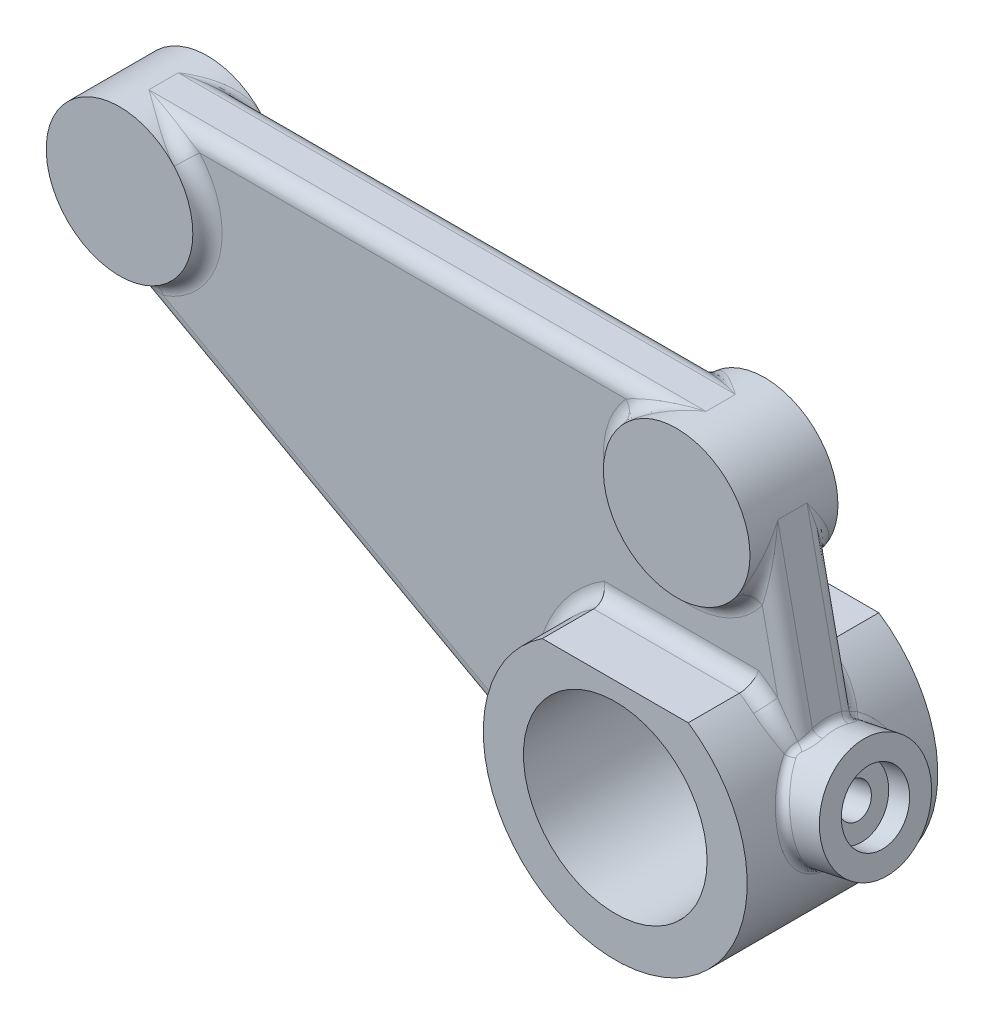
SolidWorks part; units mm, degrees
ref_plane "Front" through (0, 0, 0) normal (0, 0, 1) x (1, 0, 0)
ref_plane "Top" through (0, 0, 0) normal (0, 1, 0) x (1, 0, 0)
ref_plane "Right" through (0, 0, 0) normal (1, 0, 0) x (0, 0, -1)
sketch "Sketch1" plane through (0, 0, 0) normal (0, 0, 1) x (1, 0, 0)
  line L0 (-74.6231, 42) -> (1.3769, 42)
  line L1 (11.1584, 34.0791) -> (17.6067, 3.7424)
  line L2 (-8.6895, -15.7637) -> (-79.4506, 23.2424)
  line L3 (0, 0) -> (0, 28.3183) construction
  arc A0 (-74.6231, 42) -> (-79.4506, 23.2424) centre (-74.6231, 32) ccw
  arc A1 (11.1584, 34.0791) -> (1.3769, 42) centre (1.3769, 32) ccw
  arc A2 (17.6067, 3.7424) -> (-8.6895, -15.7637) centre (0, 0) cw
  dimension "D1" = 20
  dimension "D2" = 76
  dimension "D3" = 32
  dimension "D4" = 36
  dimension "D5" = 12
extrude "Base-Extrude" add sketch "Sketch1" along normal mid plane 8
sketch "Sketch2" plane through (0, 0, 0) normal (0, 0, 1) x (1, 0, 0)
  line L0 (-9.9499, 15) -> (9.9499, 15)
  arc A0 (-9.9499, 15) -> (9.9499, 15) centre (0, 0) ccw
  arc A1 (-8.6895, -15.7637) -> (17.6067, 3.7424) centre (0, 0) ccw construction
  arc A2 (-8.6895, -15.7637) -> (17.6067, 3.7424) centre (0, 0) ccw construction
  dimension "D1" = 15
extrude "Boss-Extrude1" add sketch "Sketch2" along normal mid plane 26
sketch "Sketch3" plane through (0, 0, 0) normal (0, 0, 1) x (1, 0, 0)
  circle A0 centre (-74.6231, 32) radius 10
  arc A1 (-74.6231, 42) -> (-79.4506, 23.2424) centre (-74.6231, 32) ccw construction
extrude "Boss-Extrude2" add sketch "Sketch3" along normal mid plane 12
sketch "Sketch4" plane through (119.7373, 2.0597, 0) normal (0, 0, 1) x (1, 0, 0)
  circle A0 centre (-118.3604, 29.9403) radius 10
  arc A2 (-108.5789, 32.0194) -> (-118.3604, 39.9403) centre (-118.3604, 29.9403) ccw construction
extrude "Boss-Extrude3" add sketch "Sketch4" along normal mid plane 12
sketch "Sketch6" plane through (0, 0, 0) normal (0, 0, 1) x (1, 0, 0)
  circle A0 centre (0, 0) radius 12.525
  dimension "D1" = 25.05
extrude "Cut-Extrude1" cut sketch "Sketch6" against normal through all and the other way through all
fillet "Fillet2" radius 2 6 edges at (14.3825, 18.9108, 4) (-36.6231, 42, 4) (-36.6231, 42, -4) (14.3825, 18.9108, -4) (-44.07, 3.7394, 4) (-44.07, 3.7394, -4)
fillet "Fillet3" radius 2 21 edges at (12.0783, 13.3459, -4) (12.0783, 13.3459, 4) (0, 15, 4) (-4.9163, 24.2285, -4) (-17.6519, 3.523, -4) (-64.9387, 29.5076, -4) (-4.9163, 24.2285, 4) (-64.9387, 29.5076, 4) (-17.6519, 3.523, 4) (-12.7501, -12.7057, -3.5349) (-75.0862, 22.0107, -3.748) (-12.7501, -12.7057, 3.5349) (-75.0862, 22.0107, 3.748) (-70.2064, 40.9718, -3.748) (-3.0398, 40.9718, -3.748) (-70.2064, 40.9718, 3.748) (-3.0398, 40.9718, 3.748) (11.0709, 29.5451, -3.748) (15.8583, 8.5155, -3.5349) (11.0709, 29.5451, 3.748) (15.8583, 8.5155, 3.5349)
ref_plane "cbore-pl" through (22.4974, 4.782, 0) normal (0.9781, 0.2079, 0) x (0, 0, -1)
sketch "Sketch8" plane through (22.4974, 4.782, 0) normal (0.9781, 0.2079, 0) x (0, 0, -1)
  circle A0 centre (0, 0) radius 7.5
  dimension "D1" = 15
extrude "Boss-Extrude5" add sketch "Sketch8" against normal up to next
fillet "Fillet5" radius 1 8 edges at (14.0019, 11.3113, 5.5564) (15.4042, 9.8641, 3.8343) (17.5959, -3.7927, 1.3997) (15.3394, 9.5885, -4.2352) (16.0473, 11.0785, 0) (16.0487, 10.595, 2.622) (16.0319, 10.5665, -2.6864)
hole_wizard "CBORE for #8 Pan Head Machine Screw1" positions "Sketch10" profile "Sketch9" counterbore size "#8" standard "Ansi Inch"
sketch "Sketch10" plane through (22.4974, 4.782, 0) normal (0.9781, 0.2079, 0) x (0, 0, -1)
  circle A0 centre (0, 0) radius 7.5 construction
  point P0 (0, 0)
sketch "Sketch9" plane through (22.4974, 4.782, 0) normal (0, 0, 1) x (-0.2079, 0.9781, 0)
  line L0 (0, 0) -> (0, 10.475)
  line L1 (0, 10.475) -> (2.2479, 10.475)
  line L3 (2.2479, 10.475) -> (2.2479, 2.921)
  line L4 (2.2479, 2.921) -> (4.5644, 2.921)
  line L5 (4.5644, 2.921) -> (4.5644, 0)
  line L7 (4.5644, 0) -> (0, 0)
  line L11 (0, -6.35) -> (0, 107.95) construction
  dimension "Thru Hole Dia." = 4.4958
  dimension "Thru Hole Depth" = 10.475
  dimension "C'Bore Dia." = 9.1288
  dimension "C'Bore Depth" = 2.921
